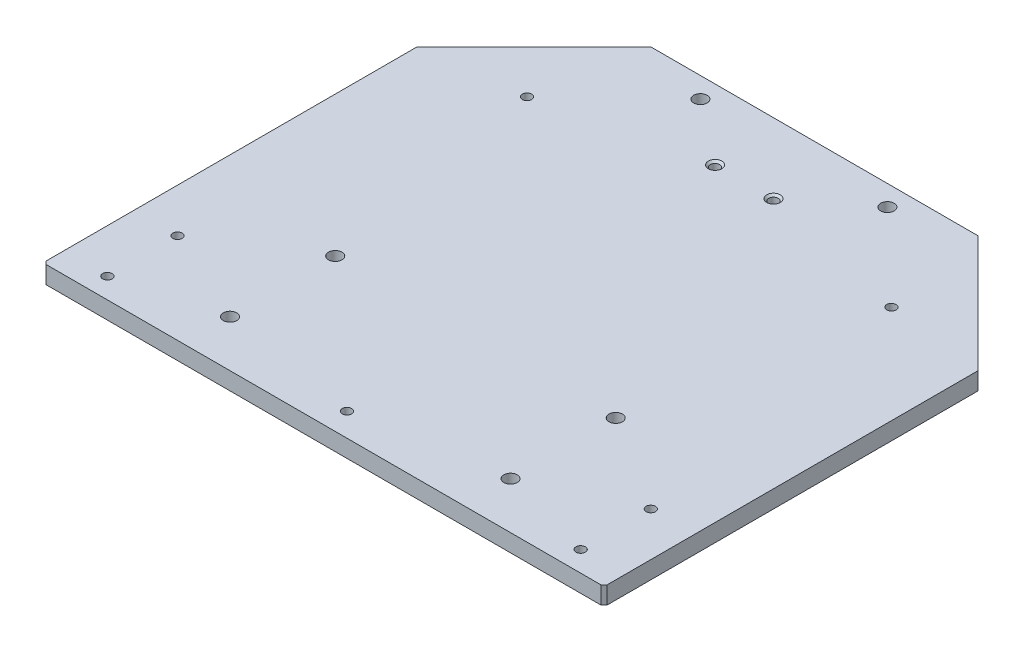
SolidWorks part; units mm, degrees
ref_plane "Front" through (0, 0, 0) normal (0, 0, 1) x (1, 0, 0)
ref_plane "Top" through (0, 0, 0) normal (0, 1, 0) x (1, 0, 0)
ref_plane "Right" through (0, 0, 0) normal (1, 0, 0) x (0, 0, -1)
sketch "Sketch1" plane through (0, 0, 0) normal (0, 1, 0) x (1, 0, 0)
  line L1 (152.4, -140.2842) -> (-152.4, -140.2842)
  line L2 (152.4, -140.2842) -> (152.4, 126.4158)
  line L3 (152.4, 126.4158) -> (-152.4, 126.4158)
  line L4 (-152.4, -140.2842) -> (-152.4, 126.4158)
  point P0 (0, 0)
  dimension "D1" = 304.8
  dimension "D2" = 266.7
  dimension "D3" = 140.2842
extrude "Boss-Extrude1" add sketch "Sketch1" along normal blind 9.525
hole_wizard "1/4-20 Tapped Hole1" positions "Sketch3" profile "Sketch5" tap size "1/4-20" standard "ANSI Inch"
sketch "Sketch3" plane through (0, 9.525, 0) normal (0, 1, 0) x (1, 0, 0)
  point P5 (-99.0092, 69.2658)
  point P8 (99.0092, 69.2658)
  point P11 (0, -127.5842)
  dimension "D1" = 99.0092
  dimension "D2" = 99.0092
  dimension "D3" = 69.2658
  dimension "D4" = 127.5842
sketch "Sketch5" plane through (-99.0092, 9.525, -69.2658) normal (1, 0, 0) x (0, 0, 1)
  line L0 (0, 0) -> (0, 9.525)
  line L1 (0, 9.525) -> (3.6576, 9.525)
  line L2 (2.5527, 8.4201) -> (2.5527, 0)
  line L5 (2.5527, 0) -> (0, 0)
  line L7 (3.6576, 9.525) -> (2.5527, 8.4201)
  line L8 (-3.6576, 9.525) -> (-2.5527, 8.4201) construction
  line L11 (0, -6.35) -> (0, 107.95) construction
  dimension "Thru Tap Drill Dia." = 5.1054
  dimension "Thru Tap Drill Depth" = 9.525
  dimension "Far C'Sink Dia." = 7.3152
  dimension "Far C'Sink Angle" = 90
hole_wizard "1/4 Clearance Hole1" positions "Sketch8" profile "Sketch9" hole size "1/4" standard "ANSI Inch"
sketch "Sketch8" plane through (0, 0, 0) normal (0, -1, 0) x (-1, 0, 0)
  line L0 (-152.4, 126.4158) -> (152.4, 126.4158) construction
  line L1 (152.4, 126.4158) -> (152.4, -140.2842) construction
  point P0 (127, 115.2906)
  point P2 (50.8, 115.2906)
  point P4 (-50.8, 115.2906)
  point P6 (-127, 115.2906)
  dimension "D1" = 11.1252
  dimension "D2" = 25.4
  dimension "D3" = 76.2
  dimension "D4" = 177.8
  dimension "D5" = 76.2
sketch "Sketch9" plane through (-127, 0, -115.2906) normal (1, 0, 0) x (0, 0, -1)
  line L0 (0, 0) -> (0, 9.525)
  line L1 (0, 9.525) -> (3.6576, 9.525)
  line L2 (3.6576, 9.525) -> (3.6576, 0)
  line L5 (3.6576, 0) -> (0, 0)
  line L11 (0, -6.35) -> (0, 107.95) construction
  dimension "Thru Hole Dia." = 7.3152
  dimension "Thru Hole Depth" = 9.525
hole_wizard "1/4 Clearance Hole2" positions "Sketch11" profile "Sketch12" hole size "1/4" standard "ANSI Inch"
sketch "Sketch11" plane through (0, 0, 0) normal (0, -1, 0) x (-1, 0, 0)
  point P0 (-76.2, -57.7342)
  point P3 (-76.2, -114.8842)
  point P6 (76.2, -114.8842)
  point P9 (76.2, -57.7342)
  dimension "D1" = 76.2
  dimension "D2" = 76.2
  dimension "D3" = 57.7342
  dimension "D4" = 57.15
sketch "Sketch12" plane through (76.2, 0, 57.7342) normal (1, 0, 0) x (0, 0, -1)
  line L0 (0, 0) -> (0, 9.525)
  line L1 (0, 9.525) -> (3.6576, 9.525)
  line L2 (3.6576, 9.525) -> (3.6576, 0)
  line L5 (3.6576, 0) -> (0, 0)
  line L11 (0, -6.35) -> (0, 107.95) construction
  dimension "Thru Hole Dia." = 7.3152
  dimension "Thru Hole Depth" = 9.525
hole_wizard "1/4-20 Tapped Hole2" positions "Sketch13" profile "Sketch14" tap size "1/4-20" standard "ANSI Inch"
sketch "Sketch13" plane through (0, 0, 0) normal (0, -1, 0) x (-1, 0, 0)
  line L0 (152.4, -140.2842) -> (-152.4, -140.2842) construction
  line L1 (152.4, 126.4158) -> (152.4, -140.2842) construction
  line L2 (-152.4, -140.2842) -> (-152.4, 126.4158) construction
  point P0 (128.5875, -129.159)
  point P2 (128.5875, -91.059)
  point P4 (-128.5748, -129.159)
  point P6 (-128.5748, -91.059)
  dimension "D2" = 11.1252
  dimension "D1" = 38.1
  dimension "D4" = 23.8125
  dimension "D5" = 23.8252
sketch "Sketch14" plane through (-128.5875, 0, 129.159) normal (1, 0, 0) x (0, 0, -1)
  line L0 (0, 0) -> (0, 9.525)
  line L1 (0, 9.525) -> (2.5527, 9.525)
  line L2 (2.5527, 9.525) -> (2.5527, 1.1049)
  line L3 (2.5527, 1.1049) -> (3.6576, 0)
  line L5 (3.6576, 0) -> (0, 0)
  line L6 (-2.5527, 1.1049) -> (-3.6576, 0) construction
  line L11 (0, -6.35) -> (0, 107.95) construction
  dimension "Thru Tap Drill Dia." = 5.1054
  dimension "Thru Tap Drill Depth" = 9.525
  dimension "Near C'Sink Dia." = 7.3152
  dimension "Near C'Sink Angle" = 90
chamfer "Chamfer1" distance 1.5875 angle 45 2 edges at (-152.4, 4.7625, 140.2842) (152.4, 4.7625, 140.2842)
chamfer "Chamfer3" distance 63.5 angle 45 2 edges at (152.4, 4.7625, -126.4158) (-152.4, 4.7625, -126.4158)
hole_wizard "1/4-20 Tapped Hole3" positions "Sketch15" profile "Sketch16" tap size "1/4-20" standard "ANSI Inch"
sketch "Sketch15" plane through (0, 9.525, 0) normal (0, 1, 0) x (1, 0, 0)
  point P0 (-15.875, 88.3158)
  point P2 (15.875, 88.3158)
  dimension "D1" = 15.875
  dimension "D2" = 31.75
  dimension "D3" = 88.3158
sketch "Sketch16" plane through (-15.875, 9.525, -88.3158) normal (1, 0, 0) x (0, 0, 1)
  line L0 (0, 0) -> (0, 9.525)
  line L1 (0, 9.525) -> (2.5527, 9.525)
  line L2 (2.5527, 9.525) -> (2.5527, 1.1049)
  line L3 (2.5527, 1.1049) -> (3.6576, 0)
  line L5 (3.6576, 0) -> (0, 0)
  line L6 (-2.5527, 1.1049) -> (-3.6576, 0) construction
  line L11 (0, -6.35) -> (0, 107.95) construction
  dimension "Thru Tap Drill Dia." = 5.1054
  dimension "Thru Tap Drill Depth" = 9.525
  dimension "Near C'Sink Dia." = 7.3152
  dimension "Near C'Sink Angle" = 90
